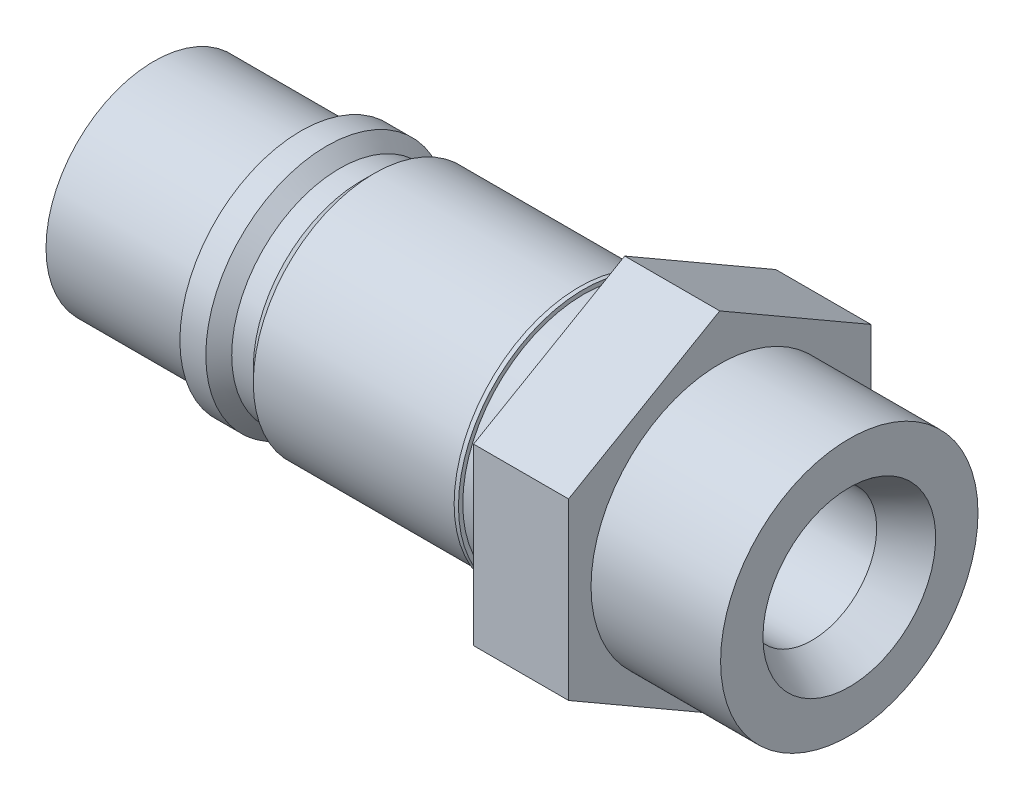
SolidWorks part; units mm, degrees
ref_plane "Alzado" through (0, 0, 0) normal (0, 0, 1) x (1, 0, 0)
ref_plane "Planta" through (0, 0, 0) normal (0, 1, 0) x (1, 0, 0)
ref_plane "Vista lateral" through (0, 0, 0) normal (1, 0, 0) x (0, 0, -1)
sketch "Croquis1" plane through (0, 0, 0) normal (0, 0, 1) x (1, 0, 0)
  line L0 (0, 0) -> (109, 0) construction
  line L1 (0, 0) -> (0, 25)
  line L2 (0, 25) -> (34, 25)
  line L3 (34, 25) -> (34, 28)
  line L4 (34, 28) -> (40, 28)
  line L5 (40, 28) -> (43, 25)
  line L6 (43, 25) -> (48, 25)
  line L7 (48, 25) -> (51, 28)
  line L11 (109, 28) -> (109, 0)
  line L12 (0, 0) -> (109, 0)
  line L13 (51, 28) -> (98.5, 28)
  line L14 (98.5, 28) -> (98.5, 29)
  line L15 (98.5, 29) -> (99.5, 29)
  line L16 (99.5, 29) -> (99.5, 28)
  line L17 (99.5, 28) -> (109, 28)
  dimension "D1" = 50
  dimension "D2" = 109
  dimension "D3" = 47.5
  dimension "D4" = 1
  dimension "D5" = 34
  dimension "D6" = 6
  dimension "D7" = 3
  dimension "D8" = 5
  dimension "D9" = 225
  dimension "D10" = 1
  dimension "D11" = 9.5
revolve "Revolución1" add sketch "Croquis1" angle 360 about L0
sketch "Croquis4" plane through (109, 0, 0) normal (1, 0, 0) x (0, 0, -1)
  line L1 (0, 40.4145) -> (-35, 20.2073)
  line L2 (-35, 20.2073) -> (-35, -20.2073)
  line L3 (-35, -20.2073) -> (0, -40.4145)
  line L4 (0, -40.4145) -> (35, -20.2073)
  line L5 (35, -20.2073) -> (35, 20.2073)
  line L6 (35, 20.2073) -> (0, 40.4145)
  circle A0 centre (0, 0) radius 35 construction
  dimension "D1" = 70
extrude "Saliente-Extruir2" add sketch "Croquis4" along normal blind 22
sketch "Croquis5" plane through (131, 0, 0) normal (1, 0, 0) x (0, 0, -1)
  circle A0 centre (0, 0) radius 29.8
  dimension "D1" = 59.6
extrude "Saliente-Extruir3" add sketch "Croquis5" along normal blind 30
sketch "Croquis6" plane through (0, 0, 0) normal (0, 0, 1) x (1, 0, 0)
  line L0 (0, 0) -> (161, 0) construction
  line L1 (161, -29.8) -> (161, 29.8) construction
  line L2 (0, 0) -> (0, 15)
  line L3 (0, 25) -> (0, -25) construction
  line L4 (0, 15) -> (152.3397, 15)
  line L5 (152.3397, 15) -> (161, 20)
  line L6 (161, 20) -> (161, 0)
  line L7 (0, 0) -> (161, 0)
  dimension "D1" = 30
  dimension "D2" = 20
  dimension "D3" = 30
revolve "Cortar-Revolución1" cut sketch "Croquis6" angle 360 about L0
